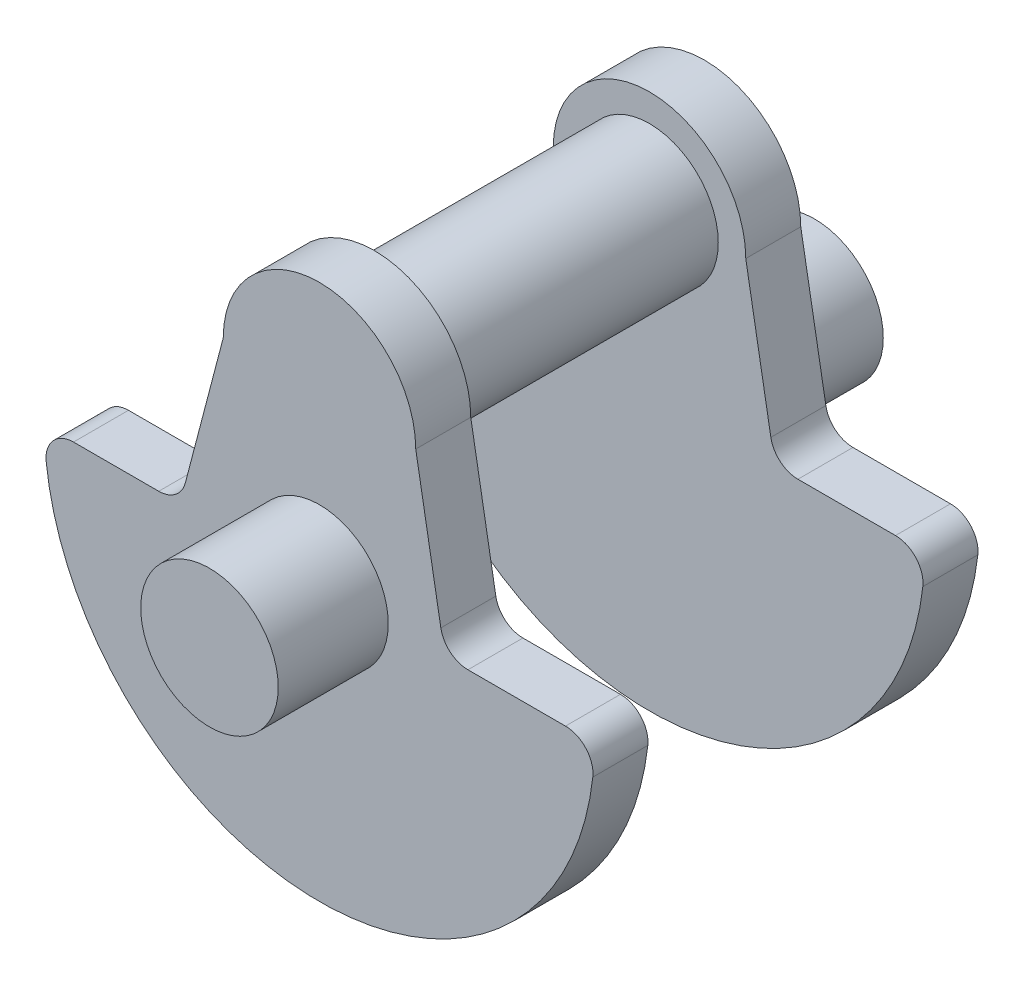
SolidWorks part; units mm, degrees
ref_plane "Front Plane" through (0, 0, 0) normal (0, 0, 1) x (1, 0, 0)
ref_plane "Top Plane" through (0, 0, 0) normal (0, 1, 0) x (1, 0, 0)
ref_plane "Right Plane" through (0, 0, 0) normal (1, 0, 0) x (0, 0, -1)
sketch "Sketch1" plane through (0, 0, 0) normal (0, 0, 1) x (1, 0, 0)
  line L0 (-17.5, 30) -> (-25.3666, 0)
  line L1 (-25.3666, 0) -> (-50, 0)
  line L2 (50, 0) -> (22.7898, 0)
  line L3 (22.7898, 0) -> (17.5, 30)
  line L4 (0, 30) -> (0, 0) construction
  circle A0 centre (0, 30) radius 17.5
  arc A1 (-50, 0) -> (50, 0) centre (0, 0) ccw
  point P8 (0, -50)
  dimension "D1" = 50
  dimension "D2" = 35
  dimension "D3" = 30
  dimension "D4" = 10
extrude "Boss-Extrude1" add sketch "Sketch1" against normal blind 10
fillet "Fillet1" radius 5 4 edges at (-25.3666, 0, -5) (50, 0, -5) (22.7898, 0, -5) (-50, 0, -5)
sketch "Sketch2" plane through (0, 0, 0) normal (0, 0, 1) x (1, 0, 0)
  circle A0 centre (0, 0) radius 12.5
  dimension "D1" = 25
extrude "Boss-Extrude2" add sketch "Sketch2" along normal blind 20
sketch "Sketch3" plane through (0, 0, -10) normal (0, 0, -1) x (-1, 0, 0)
  circle A2 centre (0, 30) radius 12.5
  dimension "D1" = 25
extrude "Boss-Extrude3" add sketch "Sketch3" along normal blind 50
ref_plane "Plane1" through (0, 0, -35) normal (0, 0, -1) x (-1, 0, 0)
mirror "Mirror2" about plane through (0, 0, -35) normal (0, 0, -1) of "Boss-Extrude1", "Fillet1", "Boss-Extrude2"
